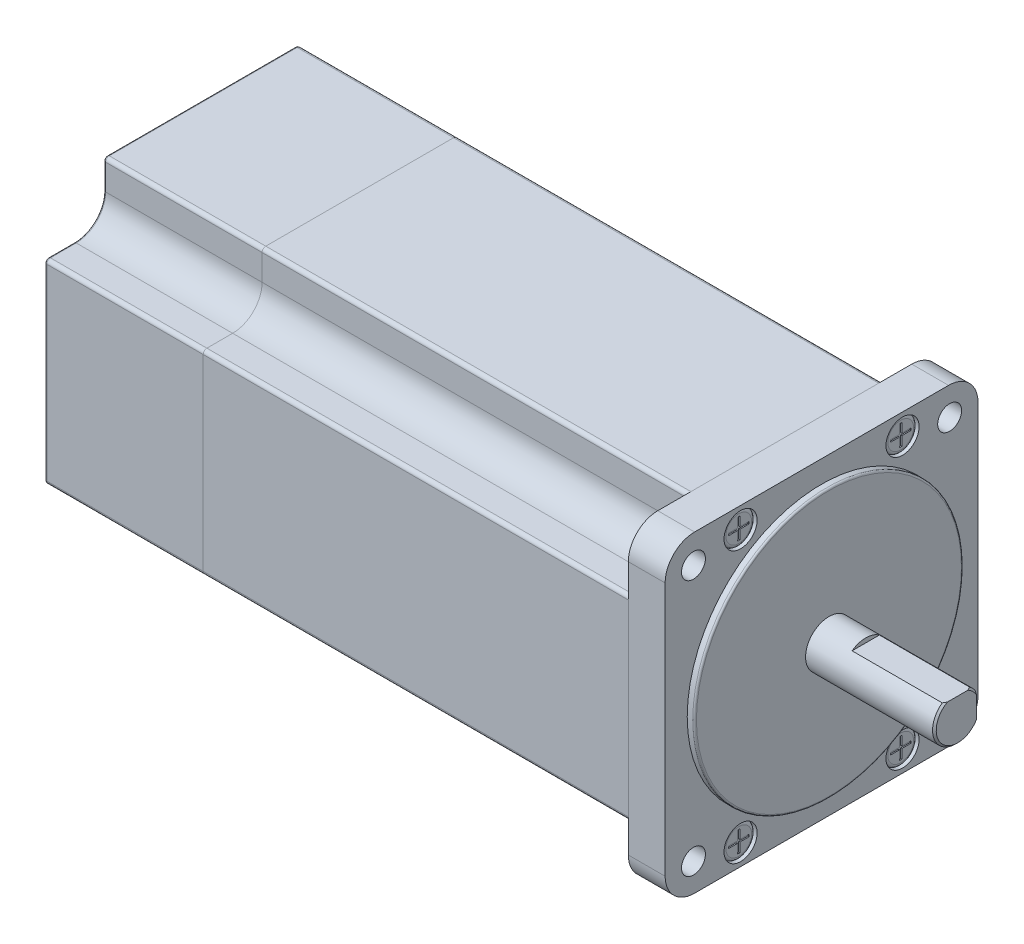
SolidWorks part; units mm, degrees
ref_plane "前视基准面" through (0, 0, 0) normal (0, 0, 1) x (1, 0, 0)
ref_plane "上视基准面" through (0, 0, 0) normal (0, 1, 0) x (1, 0, 0)
ref_plane "右视基准面" through (0, 0, 0) normal (1, 0, 0) x (0, 0, -1)
sketch "草图1" plane through (0, 0, 0) normal (1, 0, 0) x (0, 0, -1)
  line L2 (42.5, 34.5) -> (42.5, -34.5)
  line L3 (34.5, -42.5) -> (-34.5, -42.5)
  line L4 (-42.5, -34.5) -> (-42.5, 34.5)
  line L5 (-34.5, 42.5) -> (34.5, 42.5)
  arc A0 (-42.5, -34.5) -> (-34.5, -42.5) centre (-34.5, -34.5) ccw
  arc A1 (34.5, -42.5) -> (42.5, -34.5) centre (34.5, -34.5) ccw
  arc A2 (42.5, 34.5) -> (34.5, 42.5) centre (34.5, 34.5) ccw
  arc A3 (-42.5, 34.5) -> (-34.5, 42.5) centre (-34.5, 34.5) cw
  dimension "D1" = 8
extrude "凸台-拉伸1" add sketch "草图1" against normal blind 10
sketch "草图2" plane through (-10, 0, 0) normal (-1, 0, 0) x (0, 0, 1)
  line L0 (26.5, -34.5) -> (26.5, -41.5)
  line L1 (34.5, -42.5) -> (-34.5, -42.5) construction
  line L2 (-26.5, -42.5) -> (25.5, -42.5)
  line L3 (42.5, -25.5) -> (42.5, 25.5)
  line L4 (25.5, 42.5) -> (-25.5, 42.5)
  line L5 (42.5, 34.5) -> (42.5, -34.5) construction
  line L6 (41.5, -26.5) -> (34.5, -26.5)
  line L7 (-42.5, 25.5) -> (-42.5, -25.5)
  line L8 (34.5, 26.5) -> (41.5, 26.5)
  line L12 (-34.5, 42.5) -> (34.5, 42.5) construction
  line L13 (26.5, 41.5) -> (26.5, 34.5)
  line L15 (-26.5, 34.5) -> (-26.5, 41.5)
  line L19 (-42.5, -34.5) -> (-42.5, 34.5) construction
  line L20 (-41.5, 26.5) -> (-34.5, 26.5)
  line L22 (-34.5, -26.5) -> (-41.5, -26.5)
  line L26 (-26.5, -42.5) -> (-26.5, -34.5)
  arc A0 (25.5, -42.5) -> (26.5, -41.5) centre (25.5, -41.5) ccw
  arc A1 (-34.5, 26.5) -> (-26.5, 34.5) centre (-34.5, 34.5) ccw
  arc A2 (26.5, 34.5) -> (34.5, 26.5) centre (34.5, 34.5) ccw
  arc A3 (34.5, -26.5) -> (26.5, -34.5) centre (34.5, -34.5) ccw
  arc A4 (-26.5, -34.5) -> (-34.5, -26.5) centre (-34.5, -34.5) ccw
  arc A5 (41.5, -26.5) -> (42.5, -25.5) centre (41.5, -25.5) ccw
  arc A6 (42.5, 25.5) -> (41.5, 26.5) centre (41.5, 25.5) ccw
  arc A7 (25.5, 42.5) -> (26.5, 41.5) centre (25.5, 41.5) cw
  arc A8 (-25.5, 42.5) -> (-26.5, 41.5) centre (-25.5, 41.5) ccw
  arc A9 (-41.5, 26.5) -> (-42.5, 25.5) centre (-41.5, 25.5) ccw
  arc A10 (-42.5, -25.5) -> (-41.5, -26.5) centre (-41.5, -25.5) ccw
  point P7 (26.5, -42.5)
  point P17 (42.5, -26.5)
  point P34 (42.5, 26.5)
  point P45 (26.5, 42.5)
  point P51 (-26.5, 42.5)
  point P54 (-42.5, 26.5)
  point P57 (-42.5, -26.5)
  dimension "D1" = 1
extrude "凸台-拉伸2" add sketch "草图2" along normal blind 115.5 separate body
sketch "草图3" plane through (-125.5, 0, 0) normal (-1, 0, 0) x (0, 0, 1)
  line L0 (-26.5, -42.5) -> (-26.5, -41.5)
  line L1 (-26.5, -34.5) -> (-26.5, -42.5) construction
  line L3 (-26.5, -42.5) -> (-25.5, -42.5)
  arc A0 (-26.5, -41.5) -> (-25.5, -42.5) centre (-25.5, -41.5) ccw
extrude "切除-拉伸1" cut sketch "草图3" against normal blind 115.5
sketch "草图4" plane through (0, 0, 0) normal (1, 0, 0) x (0, 0, -1)
  circle A0 centre (0, 0) radius 36.5
extrude "凸台-拉伸3" add sketch "草图4" along normal blind 2
sketch "草图5" plane through (2, 0, 0) normal (1, 0, 0) x (0, 0, -1)
  circle A0 centre (0, 0) radius 6.35
extrude "凸台-拉伸4" add sketch "草图5" along normal blind 35
chamfer "倒角1" distance 0.5 angle 45 1 edges at (37, 0, -6.35)
sketch "草图6" plane through (37, 0, 0) normal (1, 0, 0) x (0, 0, -1)
  line L2 (3.7148, 5.15) -> (-3.7148, 5.15)
  line L3 (5.15, 3.7148) -> (5.15, -3.7148)
  arc A0 (5.15, -3.7148) -> (-3.7148, 5.15) centre (0, 0) ccw
extrude "切除-拉伸2" cut sketch "草图6" against normal blind 25 contours L3 M1 | L3 A0 M1 | L2 A0 M1 | L2 M1
sketch "草图8" plane through (0, 0, 0) normal (1, 0, 0) x (0, 0, -1)
  circle A0 centre (-34.8, 34.8) radius 3.25
  circle A1 centre (34.8, 34.8) radius 3.25
  circle A2 centre (34.8, -34.8) radius 3.25
  circle A3 centre (-34.8, -34.8) radius 3.25
extrude "切除-拉伸3" cut sketch "草图8" against normal blind 10
sketch "草图9" plane through (0, 0, 0) normal (1, 0, 0) x (0, 0, -1)
  circle A0 centre (22, -36.8) radius 4.5
  circle A1 centre (-22, -36.8) radius 4.5
  circle A2 centre (22, 36.8) radius 4.5
  circle A3 centre (-22, 36.8) radius 4.5
extrude "切除-拉伸5" cut sketch "草图9" against normal blind 1.5
sketch "草图13" plane through (-1.5, 0, 0) normal (1, 0, 0) x (0, 0, -1)
  circle A0 centre (-22, -36.8) radius 4.5
  circle A1 centre (22, 36.8) radius 4.5
  circle A2 centre (-22, 36.8) radius 4.5
  circle A3 centre (22, -36.8) radius 4.5
extrude "凸台-拉伸6" add sketch "草图13" along normal blind 1 separate body
fillet "圆角2" radius 1 1 edges at (-0.5, -36.8, -26.5)
fillet "圆角3" radius 1 1 edges at (-0.5, -36.8, 17.5)
fillet "圆角4" radius 1 1 edges at (-0.5, 36.8, 17.5)
fillet "圆角5" radius 1 1 edges at (-0.5, 36.8, -26.5)
sketch "草图14" plane through (-0.5, 0, 0) normal (1, 0, 0) x (0, 0, -1)
  line L0 (21.7, 36.5) -> (21.7, 33.9975)
  line L1 (22.3, 36.5) -> (24.7962, 36.5)
  line L4 (-22.3, 37.1) -> (-24.8, 37.1)
  line L5 (-24.8, 37.1) -> (-24.8, 36.5)
  line L6 (-24.8, 36.5) -> (-22.3, 36.5)
  line L7 (-19.2, 36.5) -> (-19.2, 37.1)
  line L8 (-19.2, 37.1) -> (-21.7, 37.1)
  line L10 (-21.7, 39.5968) -> (-22.3, 39.5968)
  line L11 (-22.3, 39.5968) -> (-22.3, 37.1)
  line L12 (-22.3, 33.9975) -> (-21.7, 33.9975)
  line L13 (-21.7, 33.9975) -> (-21.7, 36.5)
  line L18 (21.7, 37.1) -> (19.1955, 37.1)
  line L19 (19.1955, 37.1) -> (19.1955, 36.5)
  line L20 (19.1955, 36.5) -> (21.7, 36.5)
  line L21 (24.7962, 36.5) -> (24.7962, 37.1)
  line L22 (24.7962, 37.1) -> (22.3, 37.1)
  line L23 (22.3, 37.1) -> (22.3, 39.5968)
  line L24 (22.3, 39.5968) -> (21.7, 39.5968)
  line L25 (21.7, 39.5968) -> (21.7, 37.1)
  line L26 (21.7, 33.9975) -> (22.3, 33.9975)
  line L27 (22.3, 33.9975) -> (22.3, 36.5)
  line L28 (-21.7, 37.1) -> (-21.7, 39.5968)
  line L29 (-22.3, 36.5) -> (-22.3, 33.9975)
  line L30 (-21.7, 36.5) -> (-19.2, 36.5)
  line L32 (21.7, -36.5) -> (21.7, -34.0041)
  line L33 (21.7, -34.0041) -> (22.3, -34.0041)
  line L34 (22.3, -34.0041) -> (22.3, -36.5)
  line L35 (22.3, -39.6066) -> (21.7, -39.6066)
  line L36 (21.7, -39.6066) -> (21.7, -37.1)
  line L37 (21.7, -37.1) -> (19.1955, -37.1)
  line L38 (19.1955, -37.1) -> (19.1955, -36.5)
  line L39 (19.1955, -36.5) -> (21.7, -36.5)
  line L40 (24.7962, -36.5) -> (24.7962, -37.1)
  line L41 (24.7962, -37.1) -> (22.3, -37.1)
  line L42 (22.3, -37.1) -> (22.3, -39.6066)
  line L43 (22.3, -36.5) -> (24.7962, -36.5)
  line L47 (-21.7, -37.1) -> (-19.2, -37.1)
  line L48 (-19.2, -37.1) -> (-19.2, -36.5)
  line L49 (-19.2, -36.5) -> (-21.7, -36.5)
  line L50 (-24.8, -36.5) -> (-24.8, -37.1)
  line L51 (-24.8, -37.1) -> (-22.3, -37.1)
  line L52 (-22.3, -37.1) -> (-22.3, -39.6066)
  line L53 (-22.3, -39.6066) -> (-21.7, -39.6066)
  line L54 (-21.7, -39.6066) -> (-21.7, -37.1)
  line L55 (-21.7, -34.0041) -> (-22.3, -34.0041)
  line L56 (-22.3, -34.0041) -> (-22.3, -36.5)
  line L58 (-21.7, -36.5) -> (-21.7, -34.0041)
  line L59 (-22.3, -36.5) -> (-24.8, -36.5)
extrude "切除-拉伸6" cut sketch "草图14" against normal blind 0.3
sketch "草图15" plane through (-125.5, 0, 0) normal (-1, 0, 0) x (0, 0, 1)
  line L1 (-25.5, -42.5) -> (25.5, -42.5)
  line L2 (-42.5, -25.5) -> (-42.5, 25.5)
  line L3 (-26.5, -34.5) -> (-26.5, -41.5)
  line L4 (42.5, -25.5) -> (42.5, 25.5)
  line L5 (-41.5, -26.5) -> (-34.5, -26.5)
  line L9 (26.5, -41.5) -> (26.5, -34.5)
  line L11 (34.5, -26.5) -> (41.5, -26.5)
  line L13 (41.5, 26.5) -> (34.5, 26.5)
  line L15 (26.5, 34.5) -> (26.5, 41.5)
  line L16 (-26.5, 41.5) -> (-26.5, 34.5)
  line L18 (-34.5, 26.5) -> (-41.5, 26.5)
  line L19 (-25.5, 42.5) -> (25.5, 42.5)
  arc A0 (-34.5, 26.5) -> (-26.5, 34.5) centre (-34.5, 34.5) ccw
  arc A1 (-26.5, -41.5) -> (-25.5, -42.5) centre (-25.5, -41.5) ccw
  arc A2 (34.5, -26.5) -> (26.5, -34.5) centre (34.5, -34.5) ccw
  arc A3 (-26.5, -34.5) -> (-34.5, -26.5) centre (-34.5, -34.5) ccw
  arc A4 (-41.5, 26.5) -> (-42.5, 25.5) centre (-41.5, 25.5) ccw
  arc A5 (-25.5, 42.5) -> (-26.5, 41.5) centre (-25.5, 41.5) ccw
  arc A6 (26.5, 41.5) -> (25.5, 42.5) centre (25.5, 41.5) ccw
  arc A7 (42.5, 25.5) -> (41.5, 26.5) centre (41.5, 25.5) ccw
  arc A8 (41.5, -26.5) -> (42.5, -25.5) centre (41.5, -25.5) ccw
  arc A9 (25.5, -42.5) -> (26.5, -41.5) centre (25.5, -41.5) ccw
  arc A11 (-42.5, -25.5) -> (-41.5, -26.5) centre (-41.5, -25.5) ccw
  arc A12 (26.5, 34.5) -> (34.5, 26.5) centre (34.5, 34.5) ccw
  point P0 (0, 0)
extrude "凸台-拉伸7" add sketch "草图15" along normal blind 43 separate body
fillet "圆角6" radius 0.5 24 edges at (-168.5, 26.5, -38) (-168.5, 28.8431, -28.8431) (-168.5, 38, -26.5) (-168.5, 42.2071, -26.2071) (-168.5, 42.5, 0) (-168.5, 42.2071, 26.2071) (-168.5, 38, 26.5) (-168.5, 28.8431, 28.8431) (-168.5, 26.5, 38) (-168.5, 26.2071, 42.2071) (-168.5, 0, 42.5) (-168.5, -26.2071, 42.2071) (-168.5, -26.5, 38) (-168.5, -28.8431, 28.8431) (-168.5, -38, 26.5) (-168.5, -42.2071, 26.2071) (-168.5, -42.5, 0) (-168.5, -42.2071, -26.2071) (-168.5, -38, -26.5) (-168.5, -28.8431, -28.8431) (-168.5, -26.5, -38) (-168.5, -26.2071, -42.2071) (-168.5, 0, -42.5) (-168.5, 26.2071, -42.2071)
fillet "圆角7" radius 0.5 1 edges at (2, 0, -36.5)
